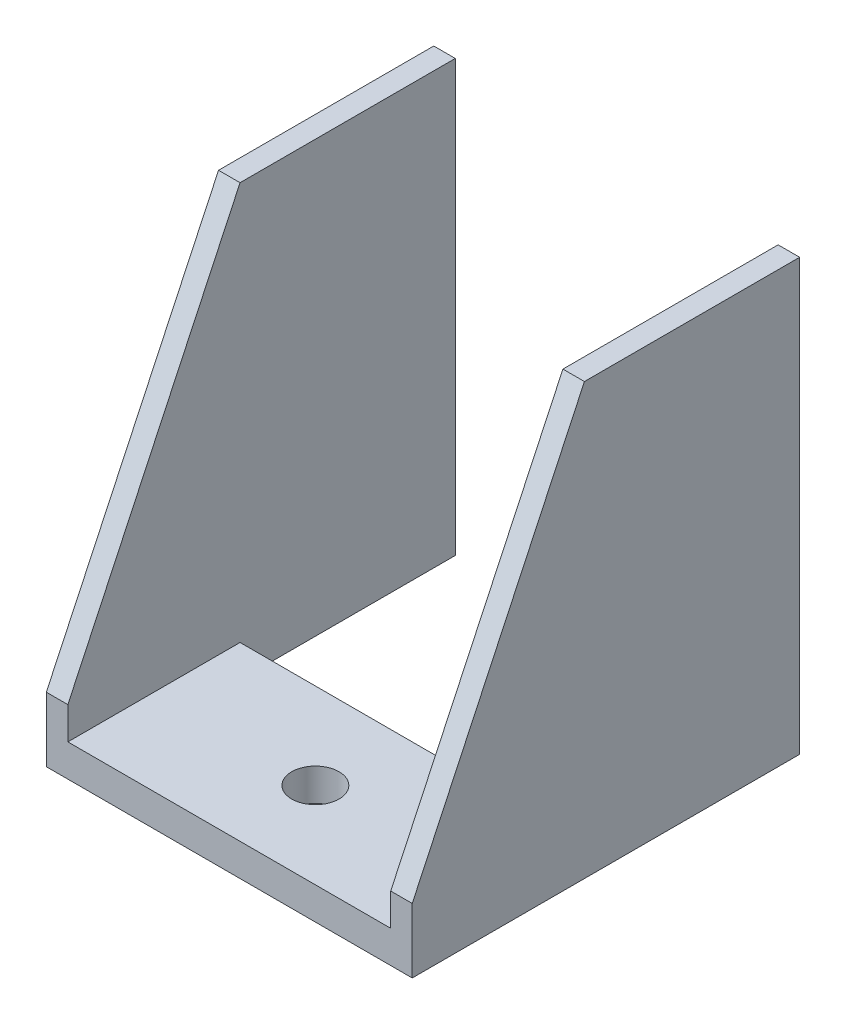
SolidWorks part; units mm, degrees
ref_plane "Front Plane" through (0, 0, 0) normal (0, 0, 1) x (1, 0, 0)
ref_plane "Top Plane" through (0, 0, 0) normal (0, 1, 0) x (1, 0, 0)
ref_plane "Right Plane" through (0, 0, 0) normal (1, 0, 0) x (0, 0, -1)
sketch "Sketch2" plane through (0, 0, 0) normal (0, 1, 0) x (1, 0, 0)
  line L1 (-75, -40) -> (75, -40)
  line L2 (-75, -40) -> (-75, 40)
  line L3 (-75, 40) -> (75, 40)
  line L4 (75, -40) -> (75, 40)
  line L5 (-75, -40) -> (75, 40) construction
  line L6 (-75, 40) -> (75, -40) construction
  circle A0 centre (0, 0) radius 11
  point P0 (0, 0)
  dimension "D3" = 22
  dimension "D1" = 80
  dimension "D2" = 150
extrude "Boss-Extrude1" add sketch "Sketch2" along normal blind 15
sketch "Sketch3" plane through (75, 0, 0) normal (1, 0, 0) x (0, 0, -1)
  line L2 (140, 0) -> (140, 200)
  line L3 (140, 200) -> (40, 200)
  line L4 (40, 200) -> (-40, 30)
  line L5 (-40, 30) -> (-40, 0)
  line L6 (-40, 0) -> (140, 0)
  line L7 (-40, 15) -> (-40, 0) construction
  point P0 (0, 0)
  point P1 (0, 0)
  point P3 (0, 0)
  point P12 (139.8498, 0)
  point P13 (0, 0)
  point P14 (0, 0)
  point P15 (134.2956, 0)
  dimension "D1" = 200
  dimension "D2" = 100
  dimension "D3" = 30
  dimension "D4" = 180
extrude "Boss-Extrude2" add sketch "Sketch3" along normal blind 10
mirror "Mirror1" about plane through (0, 0, 0) normal (1, 0, 0) of "Boss-Extrude2"
